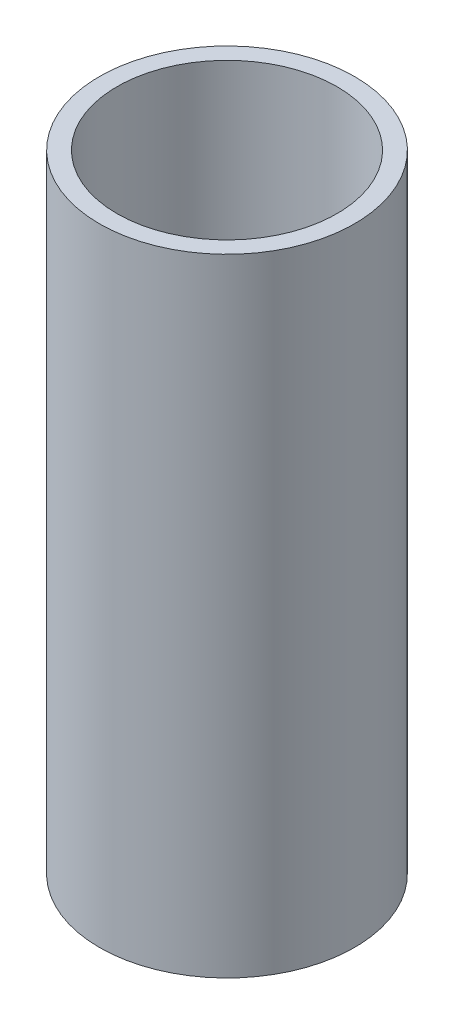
SolidWorks part; units mm, degrees
ref_plane "Front Plane" through (0, 0, 0) normal (0, 0, 1) x (1, 0, 0)
ref_plane "Top Plane" through (0, 0, 0) normal (0, 1, 0) x (1, 0, 0)
ref_plane "Right Plane" through (0, 0, 0) normal (1, 0, 0) x (0, 0, -1)
sketch "Sketch1" plane through (0, 0, 0) normal (0, 1, 0) x (1, 0, 0)
  circle A0 centre (0, 0) radius 36.449
  circle A1 centre (0, 0) radius 31.4325
  dimension "D1" = 62.865
  dimension "D2" = 72.898
extrude "Extrude1" add sketch "Sketch1" along normal blind 179.07
